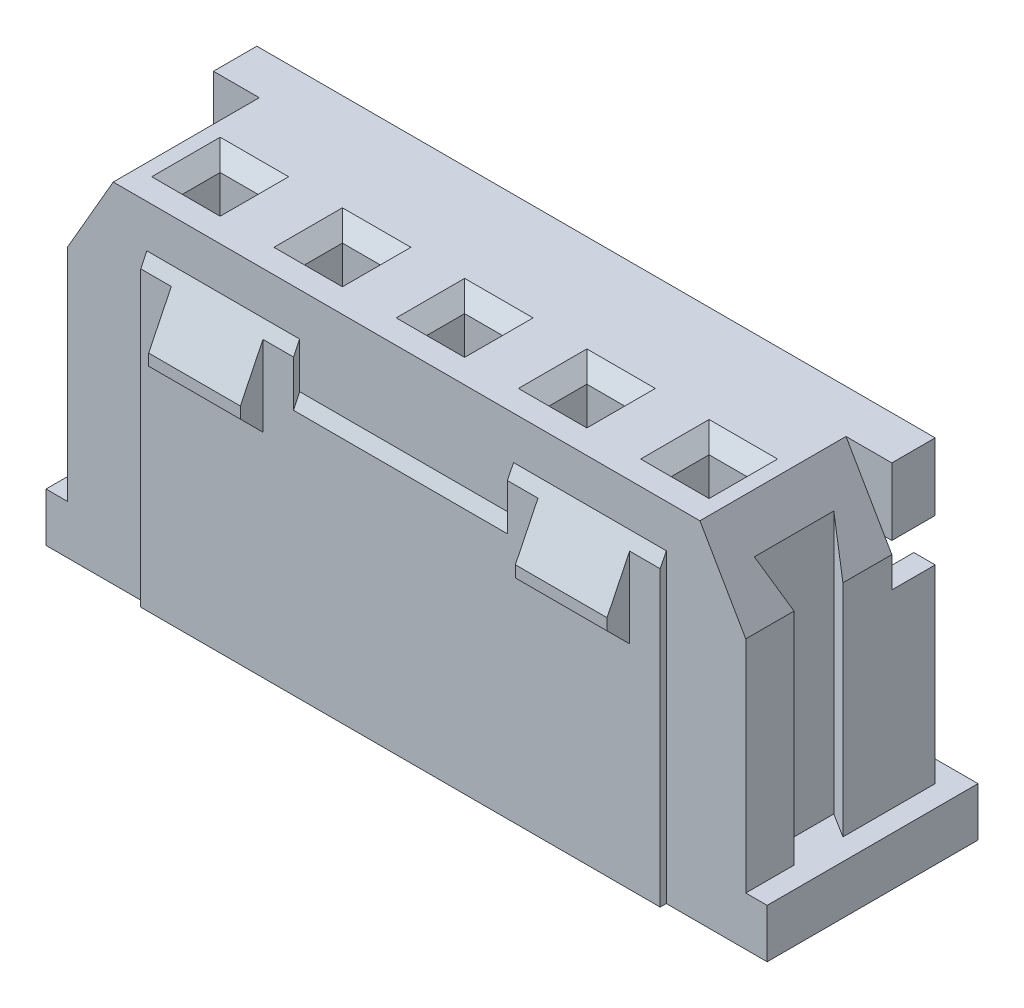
SolidWorks part; units mm, degrees
ref_plane "Front Plane" through (0, 0, 0) normal (0, 0, 1) x (1, 0, 0)
ref_plane "Top Plane" through (0, 0, 0) normal (0, 1, 0) x (1, 0, 0)
ref_plane "Right Plane" through (0, 0, 0) normal (1, 0, 0) x (0, 0, -1)
imported_body "Imported1"
sketch "Sketch1" plane through (0, 5.45, 0) normal (0, 1, 0) x (1, 0, 0)
  line L0 (4.31, -2.81) -> (4.31, -2.19) construction
  line L1 (4.31, -2.19) -> (3.69, -2.19) construction
  line L2 (3.69, -2.19) -> (3.69, -2.81) construction
  line L3 (3.69, -2.81) -> (4.31, -2.81) construction
  line L4 (-3.69, -2.81) -> (-3.69, -2.19) construction
  line L5 (-3.69, -2.19) -> (-4.31, -2.19) construction
  line L6 (-4.31, -2.19) -> (-4.31, -2.81) construction
  line L7 (-4.31, -2.81) -> (-3.69, -2.81) construction
  line L8 (2.31, -2.81) -> (2.31, -2.19) construction
  line L9 (2.31, -2.19) -> (1.69, -2.19) construction
  line L10 (1.69, -2.19) -> (1.69, -2.81) construction
  line L11 (1.69, -2.81) -> (2.31, -2.81) construction
  line L12 (0.31, -2.81) -> (0.31, -2.19) construction
  line L13 (0.31, -2.19) -> (-0.31, -2.19) construction
  line L14 (-0.31, -2.19) -> (-0.31, -2.81) construction
  line L15 (-0.31, -2.81) -> (0.31, -2.81) construction
  line L16 (-1.69, -2.81) -> (-1.69, -2.19) construction
  line L17 (-1.69, -2.19) -> (-2.31, -2.19) construction
  line L18 (-2.31, -2.19) -> (-2.31, -2.81) construction
  line L19 (-2.31, -2.81) -> (-1.69, -2.81) construction
  line L20 (4.31, -2.81) -> (4.31, -2.19)
  line L21 (4.31, -2.19) -> (3.69, -2.19)
  line L22 (3.69, -2.19) -> (3.69, -2.81)
  line L23 (3.69, -2.81) -> (4.31, -2.81)
  line L24 (-3.69, -2.81) -> (-3.69, -2.19)
  line L25 (-3.69, -2.19) -> (-4.31, -2.19)
  line L26 (-4.31, -2.19) -> (-4.31, -2.81)
  line L27 (-4.31, -2.81) -> (-3.69, -2.81)
  line L28 (2.31, -2.81) -> (2.31, -2.19)
  line L29 (2.31, -2.19) -> (1.69, -2.19)
  line L30 (1.69, -2.19) -> (1.69, -2.81)
  line L31 (1.69, -2.81) -> (2.31, -2.81)
  line L32 (0.31, -2.81) -> (0.31, -2.19)
  line L33 (0.31, -2.19) -> (-0.31, -2.19)
  line L34 (-0.31, -2.19) -> (-0.31, -2.81)
  line L35 (-0.31, -2.81) -> (0.31, -2.81)
  line L36 (-1.69, -2.81) -> (-1.69, -2.19)
  line L37 (-1.69, -2.19) -> (-2.31, -2.19)
  line L38 (-2.31, -2.19) -> (-2.31, -2.81)
  line L39 (-2.31, -2.81) -> (-1.69, -2.81)
extrude "Cut-Extrude1" cut sketch "Sketch1" against normal blind 2.54
sketch "Sketch2" plane through (0, 0.25, 0) normal (0, -1, 0) x (1, 0, 0)
  line L0 (3.36, 3.08) -> (3.36, 2.66) construction
  line L1 (3.36, 2.66) -> (3.15, 2.66) construction
  line L2 (3.15, 2.66) -> (3.15, 1.06) construction
  line L3 (3.15, 1.06) -> (3.65, 1.06) construction
  line L4 (3.65, 1.06) -> (3.65, 0.66) construction
  line L5 (3.65, 0.66) -> (4.35, 0.66) construction
  line L6 (4.35, 0.66) -> (4.35, 1.06) construction
  line L7 (4.35, 1.06) -> (4.85, 1.06) construction
  line L8 (4.85, 1.06) -> (4.85, 2.66) construction
  line L9 (4.85, 2.66) -> (4.64, 2.66) construction
  line L10 (4.64, 2.66) -> (4.64, 3.08) construction
  line L11 (4.64, 3.08) -> (3.36, 3.08) construction
  line L12 (1.36, 3.08) -> (1.36, 2.66) construction
  line L13 (1.36, 2.66) -> (1.15, 2.66) construction
  line L14 (1.15, 2.66) -> (1.15, 1.06) construction
  line L15 (1.15, 1.06) -> (1.65, 1.06) construction
  line L16 (1.65, 1.06) -> (1.65, 0.66) construction
  line L17 (1.65, 0.66) -> (2.35, 0.66) construction
  line L18 (2.35, 0.66) -> (2.35, 1.06) construction
  line L19 (2.35, 1.06) -> (2.85, 1.06) construction
  line L20 (2.85, 1.06) -> (2.85, 2.66) construction
  line L21 (2.85, 2.66) -> (2.64, 2.66) construction
  line L22 (2.64, 2.66) -> (2.64, 3.08) construction
  line L23 (2.64, 3.08) -> (1.36, 3.08) construction
  line L24 (-0.64, 3.08) -> (-0.64, 2.66) construction
  line L25 (-0.64, 2.66) -> (-0.85, 2.66) construction
  line L26 (-0.85, 2.66) -> (-0.85, 1.06) construction
  line L27 (-0.85, 1.06) -> (-0.35, 1.06) construction
  line L28 (-0.35, 1.06) -> (-0.35, 0.66) construction
  line L29 (-0.35, 0.66) -> (0.35, 0.66) construction
  line L30 (0.35, 0.66) -> (0.35, 1.06) construction
  line L31 (0.35, 1.06) -> (0.85, 1.06) construction
  line L32 (0.85, 1.06) -> (0.85, 2.66) construction
  line L33 (0.85, 2.66) -> (0.64, 2.66) construction
  line L34 (0.64, 2.66) -> (0.64, 3.08) construction
  line L35 (0.64, 3.08) -> (-0.64, 3.08) construction
  line L36 (-2.64, 3.08) -> (-2.64, 2.66) construction
  line L37 (-2.64, 2.66) -> (-2.85, 2.66) construction
  line L38 (-2.85, 2.66) -> (-2.85, 1.06) construction
  line L39 (-2.85, 1.06) -> (-2.35, 1.06) construction
  line L40 (-2.35, 1.06) -> (-2.35, 0.66) construction
  line L41 (-2.35, 0.66) -> (-1.65, 0.66) construction
  line L42 (-1.65, 0.66) -> (-1.65, 1.06) construction
  line L43 (-1.65, 1.06) -> (-1.15, 1.06) construction
  line L44 (-1.15, 1.06) -> (-1.15, 2.66) construction
  line L45 (-1.15, 2.66) -> (-1.36, 2.66) construction
  line L46 (-1.36, 2.66) -> (-1.36, 3.08) construction
  line L47 (-1.36, 3.08) -> (-2.64, 3.08) construction
  line L48 (-4.64, 3.08) -> (-4.64, 2.66) construction
  line L49 (-4.64, 2.66) -> (-4.85, 2.66) construction
  line L50 (-4.85, 2.66) -> (-4.85, 1.06) construction
  line L51 (-4.85, 1.06) -> (-4.35, 1.06) construction
  line L52 (-4.35, 1.06) -> (-4.35, 0.66) construction
  line L53 (-4.35, 0.66) -> (-3.65, 0.66) construction
  line L54 (-3.65, 0.66) -> (-3.65, 1.06) construction
  line L55 (-3.65, 1.06) -> (-3.15, 1.06) construction
  line L56 (-3.15, 1.06) -> (-3.15, 2.66) construction
  line L57 (-3.15, 2.66) -> (-3.36, 2.66) construction
  line L58 (-3.36, 2.66) -> (-3.36, 3.08) construction
  line L59 (-3.36, 3.08) -> (-4.64, 3.08) construction
  line L60 (3.36, 3.08) -> (3.36, 2.66)
  line L61 (3.36, 2.66) -> (3.15, 2.66)
  line L62 (3.15, 2.66) -> (3.15, 1.06)
  line L63 (3.15, 1.06) -> (3.65, 1.06)
  line L64 (3.65, 1.06) -> (3.65, 0.66)
  line L65 (3.65, 0.66) -> (4.35, 0.66)
  line L66 (4.35, 0.66) -> (4.35, 1.06)
  line L67 (4.35, 1.06) -> (4.85, 1.06)
  line L68 (4.85, 1.06) -> (4.85, 2.66)
  line L69 (4.85, 2.66) -> (4.64, 2.66)
  line L70 (4.64, 2.66) -> (4.64, 3.08)
  line L71 (4.64, 3.08) -> (3.36, 3.08)
  line L72 (1.36, 3.08) -> (1.36, 2.66)
  line L73 (1.36, 2.66) -> (1.15, 2.66)
  line L74 (1.15, 2.66) -> (1.15, 1.06)
  line L75 (1.15, 1.06) -> (1.65, 1.06)
  line L76 (1.65, 1.06) -> (1.65, 0.66)
  line L77 (1.65, 0.66) -> (2.35, 0.66)
  line L78 (2.35, 0.66) -> (2.35, 1.06)
  line L79 (2.35, 1.06) -> (2.85, 1.06)
  line L80 (2.85, 1.06) -> (2.85, 2.66)
  line L81 (2.85, 2.66) -> (2.64, 2.66)
  line L82 (2.64, 2.66) -> (2.64, 3.08)
  line L83 (2.64, 3.08) -> (1.36, 3.08)
  line L84 (-0.64, 3.08) -> (-0.64, 2.66)
  line L85 (-0.64, 2.66) -> (-0.85, 2.66)
  line L86 (-0.85, 2.66) -> (-0.85, 1.06)
  line L87 (-0.85, 1.06) -> (-0.35, 1.06)
  line L88 (-0.35, 1.06) -> (-0.35, 0.66)
  line L89 (-0.35, 0.66) -> (0.35, 0.66)
  line L90 (0.35, 0.66) -> (0.35, 1.06)
  line L91 (0.35, 1.06) -> (0.85, 1.06)
  line L92 (0.85, 1.06) -> (0.85, 2.66)
  line L93 (0.85, 2.66) -> (0.64, 2.66)
  line L94 (0.64, 2.66) -> (0.64, 3.08)
  line L95 (0.64, 3.08) -> (-0.64, 3.08)
  line L96 (-2.64, 3.08) -> (-2.64, 2.66)
  line L97 (-2.64, 2.66) -> (-2.85, 2.66)
  line L98 (-2.85, 2.66) -> (-2.85, 1.06)
  line L99 (-2.85, 1.06) -> (-2.35, 1.06)
  line L100 (-2.35, 1.06) -> (-2.35, 0.66)
  line L101 (-2.35, 0.66) -> (-1.65, 0.66)
  line L102 (-1.65, 0.66) -> (-1.65, 1.06)
  line L103 (-1.65, 1.06) -> (-1.15, 1.06)
  line L104 (-1.15, 1.06) -> (-1.15, 2.66)
  line L105 (-1.15, 2.66) -> (-1.36, 2.66)
  line L106 (-1.36, 2.66) -> (-1.36, 3.08)
  line L107 (-1.36, 3.08) -> (-2.64, 3.08)
  line L108 (-4.64, 3.08) -> (-4.64, 2.66)
  line L109 (-4.64, 2.66) -> (-4.85, 2.66)
  line L110 (-4.85, 2.66) -> (-4.85, 1.06)
  line L111 (-4.85, 1.06) -> (-4.35, 1.06)
  line L112 (-4.35, 1.06) -> (-4.35, 0.66)
  line L113 (-4.35, 0.66) -> (-3.65, 0.66)
  line L114 (-3.65, 0.66) -> (-3.65, 1.06)
  line L115 (-3.65, 1.06) -> (-3.15, 1.06)
  line L116 (-3.15, 1.06) -> (-3.15, 2.66)
  line L117 (-3.15, 2.66) -> (-3.36, 2.66)
  line L118 (-3.36, 2.66) -> (-3.36, 3.08)
  line L119 (-3.36, 3.08) -> (-4.64, 3.08)
extrude "Cut-Extrude2" cut sketch "Sketch2" against normal blind 3.048
